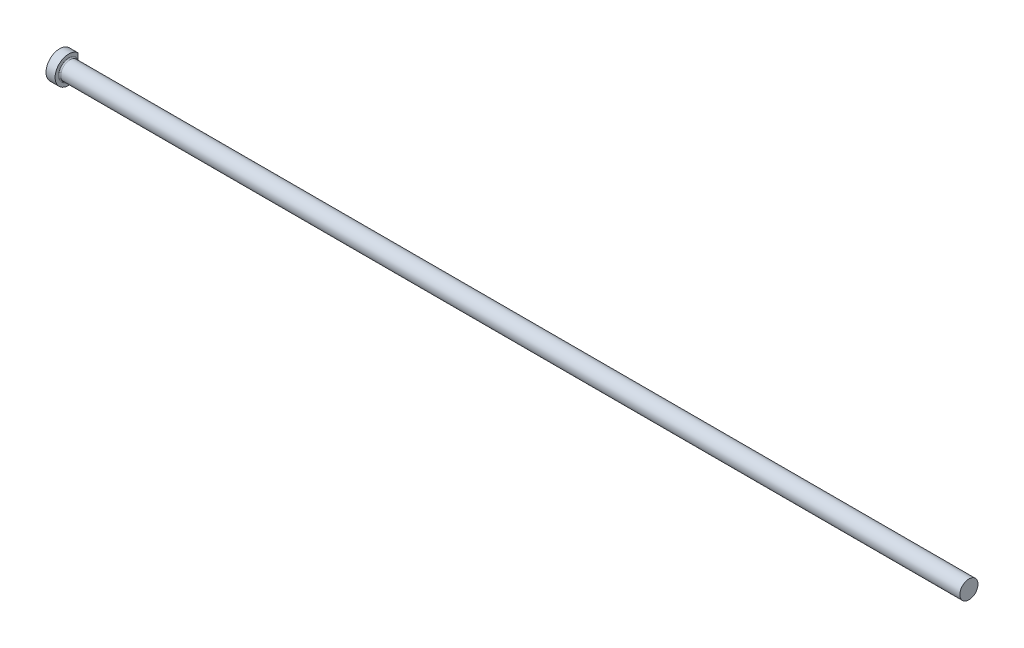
SolidWorks part; units mm, degrees
ref_plane "Front Plane" through (0, 0, 0) normal (0, 0, 1) x (1, 0, 0)
ref_plane "Top Plane" through (0, 0, 0) normal (0, 1, 0) x (1, 0, 0)
ref_plane "Right Plane" through (0, 0, 0) normal (1, 0, 0) x (0, 0, -1)
sketch "Sketch1" plane through (0, 0, 0) normal (0, 0, 1) x (1, 0, 0)
  line L0 (0, 0) -> (0, 9.525)
  line L1 (0, 9.525) -> (6.35, 9.525)
  line L2 (6.35, 9.525) -> (6.35, 7.1374)
  line L3 (7.1374, 6.35) -> (635, 6.35)
  line L4 (635, 6.35) -> (635, 0)
  line L5 (635, 0) -> (0, 0)
  line L6 (635, 0) -> (0, 0) construction
  line L7 (0, 0) -> (-10.4771, 0) construction
  line L8 (635, 0) -> (1002.3976, 0) construction
  line L9 (7.1374, 6.35) -> (-7.9138, 6.35) construction
  arc A0 (7.1374, 6.35) -> (6.35, 7.1374) centre (7.1374, 7.1374) cw
  dimension "D1" = 0.7874
  dimension "HeadDia" = 19.05
  dimension "HeadThickness" = 6.35
  dimension "PinDia" = 12.7
  dimension "overall" = 635
revolve "PIN" add sketch "Sketch1" angle 360 about L6
ref_plane "Plane1" through (321.0687, 0, -6.35) normal (0, 0, -1) x (0, -1, 0)
ref_plane "CutPlane" through (0, 0, -6.5278) normal (0, 0, -1) x (-1, 0, 0)
other "SurfaceCut1"
